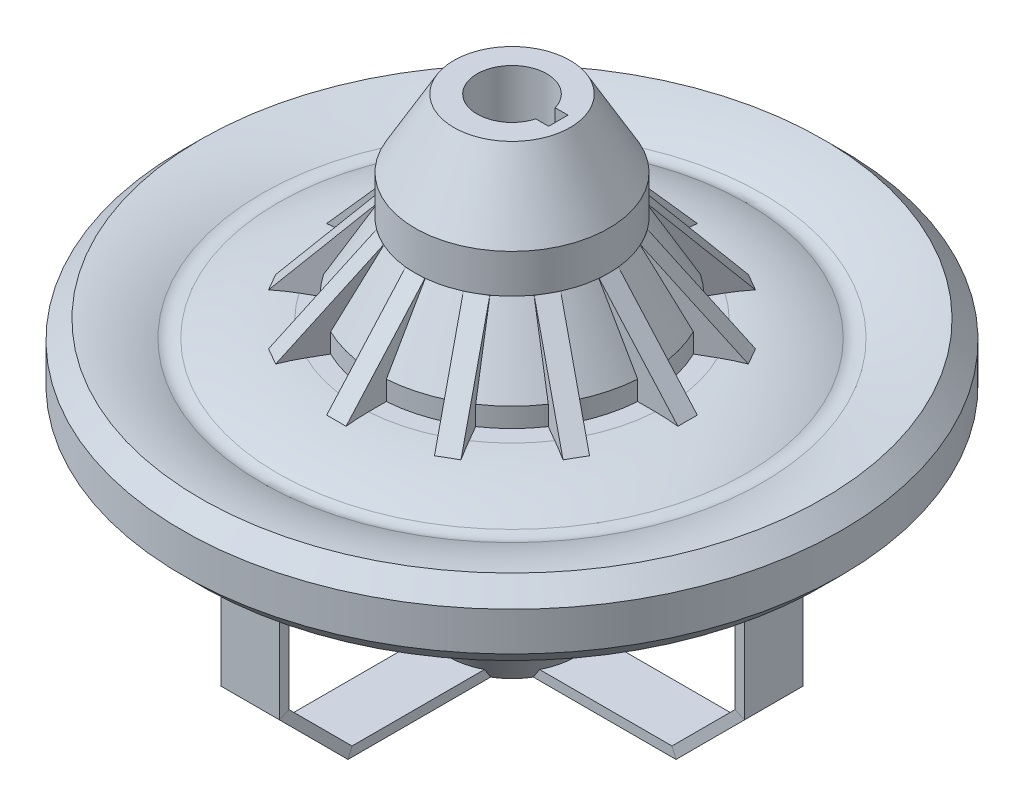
SolidWorks part; units mm, degrees
ref_plane "Front Plane" through (0, 0, 0) normal (0, 0, 1) x (1, 0, 0)
ref_plane "Top Plane" through (0, 0, 0) normal (0, 1, 0) x (1, 0, 0)
ref_plane "Right Plane" through (0, 0, 0) normal (1, 0, 0) x (0, 0, -1)
sketch "Sketch1" plane through (0, 0, 0) normal (0, 0, 1) x (1, 0, 0)
  line L0 (0, 12) -> (0, 0)
  line L5 (0, 0) -> (17, 0)
  line L7 (17, 0) -> (17, 2)
  line L12 (5, 6.5) -> (5, 8.5)
  line L13 (5, 8.5) -> (3, 12)
  line L14 (3, 12) -> (0, 12)
  line L15 (17, 2) -> (7, 2)
  line L16 (7, 2) -> (7, 3)
  line L17 (7, 3) -> (5, 6.5)
  point P0 (7.8593, 2)
  dimension "D1" = 5
  dimension "D2" = 3
  dimension "D3" = 10
  dimension "D4" = 2
  dimension "D5" = 2
  dimension "D6" = 3.5
  dimension "D7" = 17
  dimension "D8" = 1
revolve "Revolve1" add sketch "Sketch1" angle 360 about L0
sketch "Sketch2" plane through (0, 0, 0) normal (1, 0, 0) x (0, 0, -1)
  line L0 (-5, 6.5) -> (-5, 2)
  line L1 (17, 2) -> (-17, 2) construction
  line L2 (-5, 2) -> (-9, 2)
  line L3 (-9, 2) -> (-5, 6.5)
  line L5 (0, 0) -> (0, 15.0805) construction
  dimension "D1" = 9
extrude "Boss-Extrude1" add sketch "Sketch2" along normal mid plane 1
pattern_circular "CirPattern1" count 12 over 360 about axis through (0, 0, 0) along (0, 1, 0) of "Boss-Extrude1"
mirror "Mirror1" about plane through (0, 0, 0) normal (0, 1, 0)
chamfer "Chamfer1" distance 1 angle 45 2 edges at (-17, -2, 0) (-17, 2, 0)
sketch "Sketch3" plane through (0, 12, 0) normal (0, 1, 0) x (1, 0, 0)
  line L0 (2.3892, -0.5) -> (2.3892, 0.5)
  line L1 (2.3892, 0.5) -> (1.7292, 0.5)
  line L2 (0, 0) -> (2.3892, 0) construction
  line L3 (2.3892, -0.5) -> (1.7292, -0.5)
  arc A0 (1.7292, 0.5) -> (1.7292, -0.5) centre (0, 0) ccw
  point P5 (0, 0)
  point P9 (2.3892, 0)
  point P10 (2.3892, 0)
  dimension "D1" = 3.6
  dimension "D2" = 1
  dimension "D3" = 0.66
extrude "Cut-Extrude1" cut sketch "Sketch3" against normal up to next
sketch "Sketch4" plane through (0, 2, 0) normal (0, 1, 0) x (1, 0, 0)
  circle A0 centre (0, 0) radius 12.5
  circle A1 centre (0, 0) radius 17 construction
  dimension "D1" = 4.5
sketch "Sketch5" plane through (0, 0, 0) normal (0, 0, 1) x (1, 0, 0)
  line L0 (16, 2) -> (-16, 2) construction
  line L9 (12.5, 2) -> (-12.5, 2) construction
  circle A0 centre (-12.5, 2) radius 1
  point P6 (-12.5, 2)
  point P7 (-14.7076, 2)
  point P9 (-12.5, 2)
  dimension "D1" = 2
sweep "Cut-Sweep1" cut profiles "Sketch5" path "Sketch4"
fillet "Fillet1" radius 10 15 edges at (7.7942, 2, -4.5) (4.5, 2, -7.7942) (0, 2, -9) (-4.5, 2, -7.7942) (-7.7942, 2, -4.5) (-9, 2, 0) (-7.7942, 2, 4.5) (-4.5, 2, 7.7942) (0, 2, 9) (16, 2, 0) (-11.5, 2, 0) (13.5, 2, 0) (4.5, 2, 7.7942) (7.7942, 2, 4.5) (9, 2, 0)
sketch "Sketch6" plane through (0, 0, 0) normal (0, 0, 1) x (1, 0, 0)
  line L0 (-13.5, -2) -> (-13.5, -8.46)
  line L1 (-16, -2) -> (16, -2) construction
  line L2 (-13.5, -8.46) -> (-9.96, -12)
  line L3 (-9.96, -12) -> (-1.8, -12)
  point P4 (0, 0)
  point P7 (-1.8, -12)
  point P8 (-10.1328, -12)
  point P9 (-9.3977, -12)
  dimension "D1" = 13.5
  dimension "D2" = 135
  dimension "D3" = 6.46
sketch "Sketch7" plane through (0, -2, 0) normal (0, -1, 0) x (1, 0, 0)
  line L1 (-13.5, 1.5) -> (-13, 1.5)
  line L2 (-13.5, 1.5) -> (-13.5, -1.5)
  line L3 (-13.5, -1.5) -> (-13, -1.5)
  line L4 (-13, 1.5) -> (-13, -1.5)
  point P4 (-13.5, 0)
  dimension "D1" = 3
  dimension "D2" = 0.5
sweep "Sweep1" add profiles "Sketch7" path "Sketch6"
sketch "Sketch8" plane through (0, -12, 0) normal (0, -1, 0) x (1, 0, 0)
  line L0 (-4.7, -0.1732) -> (-4.7, 0.1732)
  line L1 (-2.7, -0.1732) -> (-2.7, 0.1732)
  line L2 (-2.7, 0.1732) -> (-3, 0.3464)
  line L3 (-3, 0.3464) -> (-3.3, 0.1732)
  line L4 (-3.3, 0.1732) -> (-3.3, -0.1732)
  line L5 (-3.3, -0.1732) -> (-3, -0.3464)
  line L6 (-3, -0.3464) -> (-2.7, -0.1732)
  line L7 (-4.7, 0.1732) -> (-5, 0.3464)
  line L8 (-5, 0.3464) -> (-5.3, 0.1732)
  line L9 (-5.3, 0.1732) -> (-5.3, -0.1732)
  line L10 (-5.3, -0.1732) -> (-5, -0.3464)
  line L11 (-5, -0.3464) -> (-4.7, -0.1732)
  line L24 (-2.7, -0.1732) -> (-4.7, -0.1732) construction
  line L25 (-6.7, -0.1732) -> (-6.7, 0.1732)
  line L26 (-6.7, 0.1732) -> (-7, 0.3464)
  line L27 (-7, 0.3464) -> (-7.3, 0.1732)
  line L28 (-7.3, 0.1732) -> (-7.3, -0.1732)
  line L29 (-7.3, -0.1732) -> (-7, -0.3464)
  line L30 (-7, -0.3464) -> (-6.7, -0.1732)
  line L31 (-8.7, -0.1732) -> (-8.7, 0.1732)
  line L32 (-8.7, 0.1732) -> (-9, 0.3464)
  line L33 (-9, 0.3464) -> (-9.3, 0.1732)
  line L34 (-9.3, 0.1732) -> (-9.3, -0.1732)
  line L35 (-9.3, -0.1732) -> (-9, -0.3464)
  line L36 (-9, -0.3464) -> (-8.7, -0.1732)
  circle A0 centre (-3, 0) radius 0.3 construction
  dimension "D1" = 2.7
  dimension "D2" = 0.6
  dimension "D4" = 2
  dimension "D3" = 4
extrude "Boss-Extrude2" add sketch "Sketch8" along normal blind 0.2
fillet "Fillet2" radius 0.5 2 edges at (-13.5, -2, 0) (-13, -2, 0)
pattern_circular "CirPattern2" count 4 over 360 about axis through (0, 0, 0) along (0, 1, 0) of "Sweep1", "Boss-Extrude2", "Fillet2"
